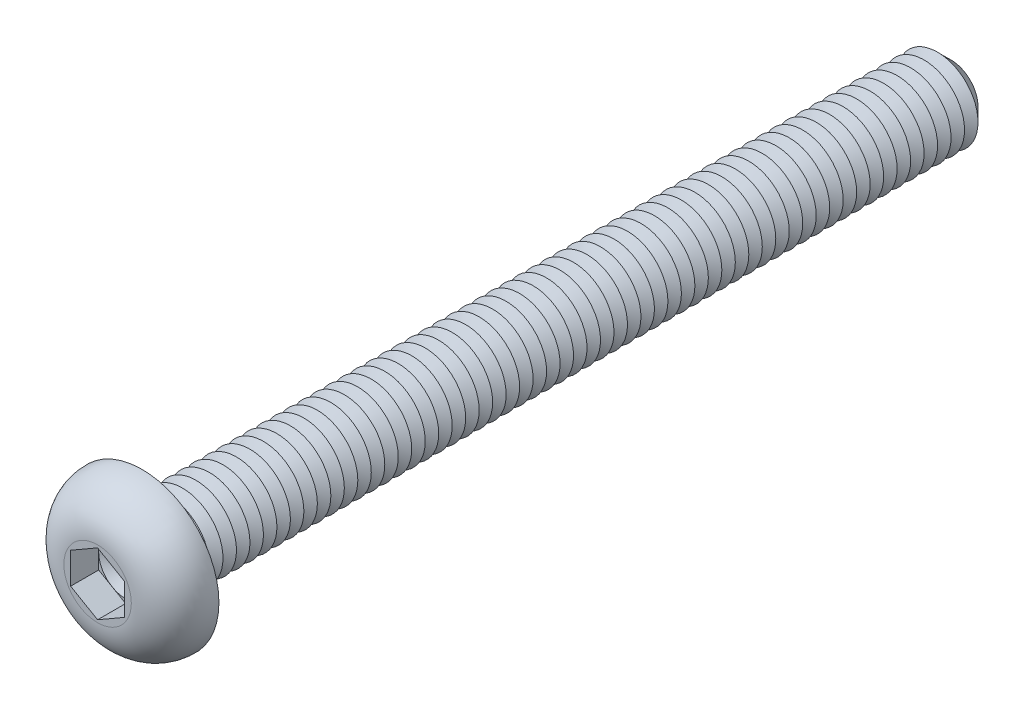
SolidWorks part; units mm, degrees
ref_plane "Front Plane" through (0, 0, 0) normal (0, 0, 1) x (1, 0, 0)
ref_plane "Top Plane" through (0, 0, 0) normal (0, 1, 0) x (1, 0, 0)
ref_plane "Right Plane" through (0, 0, 0) normal (1, 0, 0) x (0, 0, -1)
sketch "Sketch1" plane through (0, 0, 0) normal (1, 0, 0) x (0, 0, -1)
  line L0 (-47.9342, 0) -> (60.3146, 0) construction
sketch "Sketch2" plane through (0, 0, 0) normal (1, 0, 0) x (0, 0, -1)
  line L0 (0, 0) -> (-1.65, 0)
  line L1 (-47.9342, 0) -> (60.3146, 0) construction
  line L2 (-1.65, 0) -> (-1.65, 1.2508)
  line L3 (0, 2.85) -> (0, 0)
  arc A0 (-1.65, 1.2508) -> (0, 2.85) centre (-0.05, 1.2508) cw
  dimension "D1" = 1.6
  dimension "D2" = 1.65
  dimension "D3" = 2.85
revolve "Revolve1" add sketch "Sketch2" angle 360 about L0
sketch "Sketch3" plane through (0, 0, 1.65) normal (0, 0, 1) x (1, 0, 0)
  line L1 (0, 1.1547) -> (-1, 0.5774)
  line L2 (-1, 0.5774) -> (-1, -0.5774)
  line L3 (-1, -0.5774) -> (0, -1.1547)
  line L4 (0, -1.1547) -> (1, -0.5774)
  line L5 (1, -0.5774) -> (1, 0.5774)
  line L6 (1, 0.5774) -> (0, 1.1547)
  circle A0 centre (0, 0) radius 1 construction
  dimension "D1" = 2
extrude "Cut-Extrude1" cut sketch "Sketch3" against normal blind 1.04
sketch "Sketch4" plane through (0, 0, 0) normal (0, 0, -1) x (-1, 0, 0)
  circle A0 centre (0, 0) radius 1.5
  dimension "D1" = 3
extrude "Boss-Extrude1" add sketch "Sketch4" along normal blind 30
chamfer "Chamfer1" distance 0.5 angle 45 1 edges at (-1.5, 0, -30)
sketch "Sketch5" plane through (0, 0, 0) normal (1, 0, 0) x (0, 0, -1)
  line L0 (0.5, 1.5) -> (1, 1.5)
  line L1 (29.5, 1.5) -> (0, 1.5) construction
  line L2 (1, 1.5) -> (0.75, 1.067)
  line L3 (0.75, 1.067) -> (0.5, 1.5)
  line L4 (0, -2.85) -> (0, 2.85) construction
  line L5 (29.5, 1.5) -> (0, 1.5) construction
  dimension "D1" = 0.5
  dimension "D2" = 0.5
revolve "Cut-Revolve1" cut sketch "Sketch5" angle 360 about L0
pattern_linear "LPattern1" count 58 spacing 0.5 along (0, 0, -1) of "Cut-Revolve1"
fillet "Fillet2" radius 0.2 1 edges at (1.5, 0, 0)
sketch "Sketch6" plane through (0, 0, 0.61) normal (0, 0, 1) x (1, 0, 0)
  line L0 (0, -1.1547) -> (1, -0.5774) construction
  circle A0 centre (0, 0) radius 1
extrude "Cut-Extrude2" cut sketch "Sketch6" against normal through all draft 60
